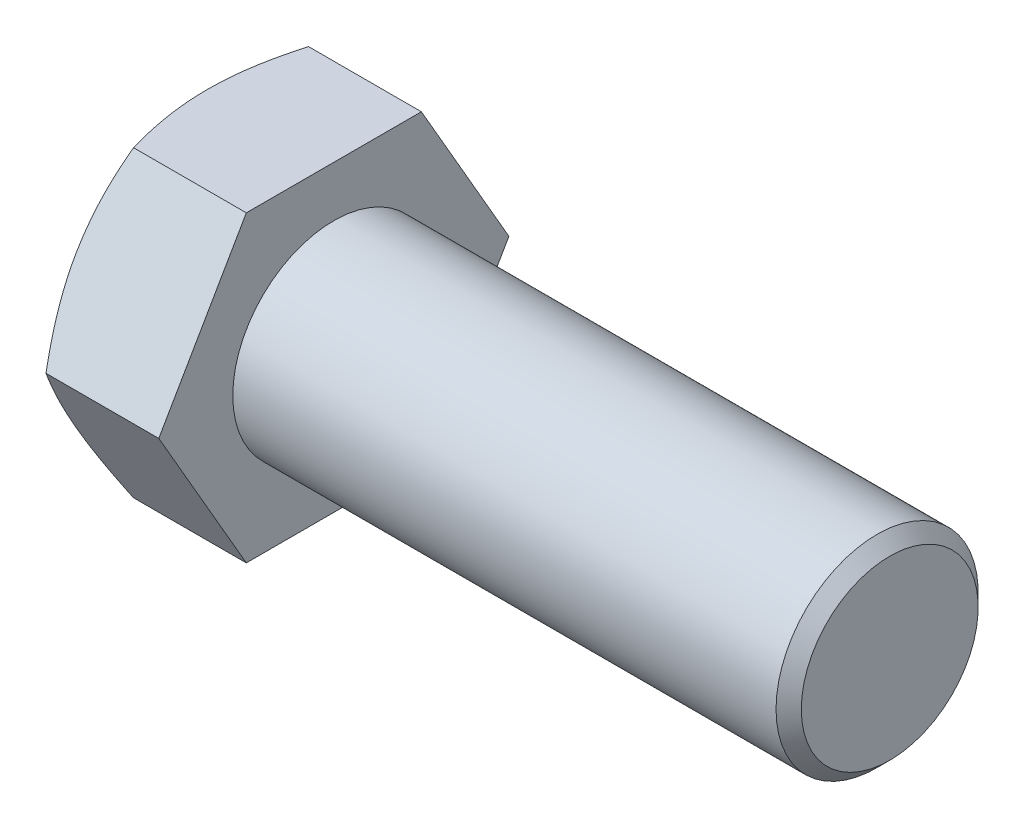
SolidWorks part; units mm, degrees
ref_plane "Plan1" through (0, 0, 0) normal (0, 0, 1) x (1, 0, 0)
ref_plane "Plan2" through (0, 0, 0) normal (0, 1, 0) x (1, 0, 0)
ref_plane "Plan3" through (0, 0, 0) normal (1, 0, 0) x (0, 0, -1)
sketch "Contour" plane through (0, 0, 0) normal (0, 0, 1) x (1, 0, 0)
  line L0 (-30, 0) -> (100, 0) construction
  line L1 (0, 8) -> (44, 8)
  line L2 (44, 8) -> (44, 0)
  line L3 (0, 8) -> (0, 13.8568)
  line L4 (0, 13.8568) -> (-8.928, 13.8568)
  line L5 (-10, 12) -> (-10, 0)
  line L6 (-10, 0) -> (44, 0)
  line L7 (-8.928, 13.8568) -> (-10, 12)
  dimension "d" = 16
  dimension "D3" = 60
  dimension "k" = 10
  dimension "l" = 44
  dimension "s" = 24
  dimension "Dt" = 27.7136
revolve "Base-Révolution" add sketch "Contour"
chamfer "Chanfrein1" distance 1 angle 45
sketch "H" plane through (-10, 0, 0) normal (-1, 0, 0) x (0, 0, 1)
  line L1 (13.8564, 0) -> (6.9282, 12)
  line L2 (6.9282, 12) -> (-6.9282, 12)
  line L3 (-6.9282, 12) -> (-13.8564, 0)
  line L4 (-13.8564, 0) -> (-6.9282, -12)
  line L5 (-6.9282, -12) -> (6.9282, -12)
  line L6 (6.9282, -12) -> (13.8564, 0)
  circle A0 centre (0, 0) radius 12 construction
  dimension "s1" = 24
extrude "Hexagone" cut sketch "H" against normal through all flip side to cut
equation "\"s1@H\" = \"s@Contour\""
equation "\"Dt@Contour\" = \"s@Contour\"/0.866"
equation "\"D1@Chanfrein1\" =  ( \"d@Contour\" - \"d@Filetage\" )  / 2"
